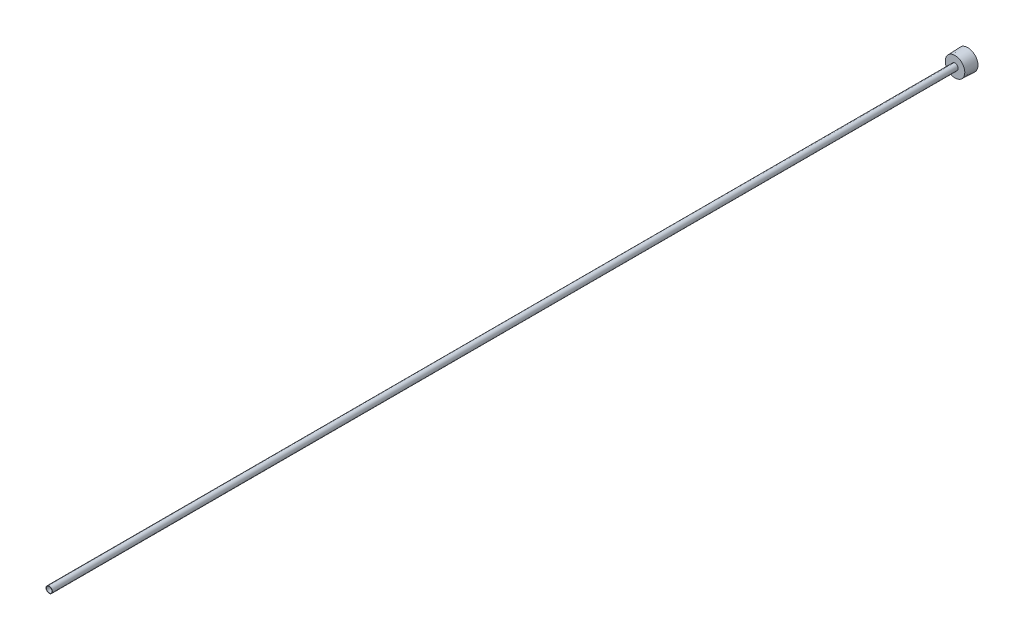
SolidWorks part; units mm, degrees
ref_plane "Front Plane" through (0, 0, 0) normal (0, 0, 1) x (1, 0, 0)
ref_plane "Top Plane" through (0, 0, 0) normal (0, 1, 0) x (1, 0, 0)
ref_plane "Right Plane" through (0, 0, 0) normal (1, 0, 0) x (0, 0, -1)
sketch "Sketch1" plane through (0, 0, 0) normal (1, 0, 0) x (0, 0, -1)
  line L5 (0, 0) -> (0, 5.0927)
  line L6 (0, 5.0927) -> (-6.35, 4.8611)
  line L7 (-6.35, 4.8611) -> (-6.35, 1.5875)
  line L8 (-6.35, 1.5875) -> (-457.2, 1.5875)
  line L9 (-457.2, 1.5875) -> (-457.2, 0)
  line L10 (0, 0) -> (50000, 0) construction
  line L11 (0, 0) -> (-457.2, 0)
  dimension "D1" = 3.175
  dimension "D2" = 10.1854
  dimension "D3" = 2.089
  dimension "D4" = 6.35
  dimension "D5" = 457.2
revolve "Revolve1" add sketch "Sketch1" angle 360 about L10
sketch "Sketch2" plane through (0, 0, 457.2) normal (0, 0, 1) x (1, 0, 0)
  circle A0 centre (0, 0) radius 1.3843
  dimension "D1" = 2.7686
extrude "Cut-Extrude1" cut sketch "Sketch2" against normal through all
sketch "Sketch3" plane through (0, 0, 0) normal (0, 0, -1) x (-1, 0, 0)
  line L0 (0, 5.602) -> (0, -5.602) construction
  line L1 (0, -3.6662) -> (3.175, -1.8331)
  line L2 (3.175, -1.8331) -> (3.175, 1.8331)
  line L3 (3.175, 1.8331) -> (0, 3.6662)
  line L4 (0, 3.6662) -> (-3.175, 1.8331)
  line L5 (-3.175, 1.8331) -> (-3.175, -1.8331)
  line L6 (-3.175, -1.8331) -> (0, -3.6662)
  circle A0 centre (0, 0) radius 3.175 construction
  dimension "D1" = 6.35
extrude "Cut-Extrude2" cut sketch "Sketch3" against normal blind 4.7625
